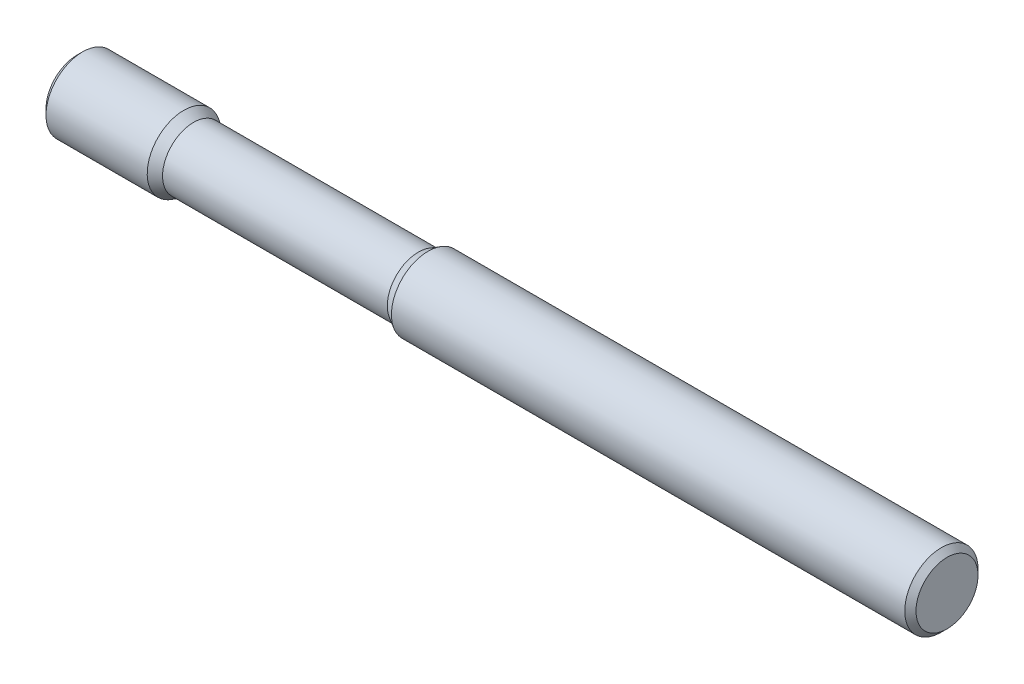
SolidWorks part; units mm, degrees
ref_plane "Plan de face" through (0, 0, 0) normal (0, 0, 1) x (1, 0, 0)
ref_plane "Plan de dessus" through (0, 0, 0) normal (0, 1, 0) x (1, 0, 0)
ref_plane "Plan de droite" through (0, 0, 0) normal (1, 0, 0) x (0, 0, -1)
ref_plane "Plan4" through (157.5, 0, 0) normal (1, 0, 0) x (0, 0, -1)
sketch "Esquisse1" plane through (0, 0, 0) normal (0, 0, 1) x (1, 0, 0)
  line L0 (0, 0) -> (0, 10.1597)
  line L1 (0, 10.1597) -> (1.8403, 12)
  line L2 (1.8403, 12) -> (35, 12)
  line L3 (35, 12) -> (38.1875, 10.1597)
  line L4 (38.1875, 10.1597) -> (111.8125, 10.1597)
  line L5 (111.8125, 10.1597) -> (115, 12)
  line L6 (115, 12) -> (283.1597, 12)
  line L7 (283.1597, 12) -> (285, 10.1597)
  line L8 (285, 10.1597) -> (285, 0)
  line L9 (285, 0) -> (0, 0)
  line L10 (285, 0) -> (0, 0) construction
  dimension "D1" = 35
  dimension "D2" = 115
  dimension "D3" = 285
  dimension "D4" = 1.8403
  dimension "D5" = 1.8403
revolve "Révolution1" add sketch "Esquisse1" angle 360 about L10
ref_plane "Plan5" through (314.999, 0, 0) normal (1, 0, 0) x (0, 0, -1)
